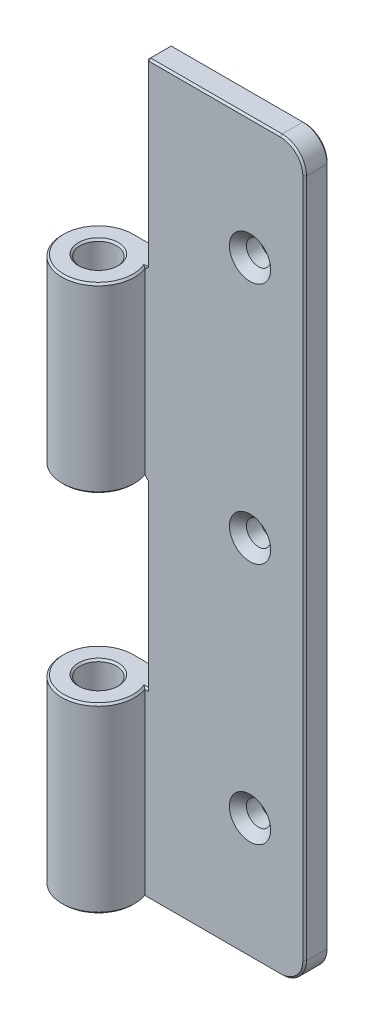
SolidWorks part; units mm, degrees
ref_plane "Спереди" through (0, 0, 0) normal (0, 0, 1) x (1, 0, 0)
ref_plane "Сверху" through (0, 0, 0) normal (0, 1, 0) x (1, 0, 0)
ref_plane "Справа" through (0, 0, 0) normal (1, 0, 0) x (0, 0, -1)
sketch "Эскиз1" plane through (0, 0, 0) normal (0, 1, 0) x (1, 0, 0)
  circle A0 centre (0, 0) radius 1.5
  circle A1 centre (0, 0) radius 3
  dimension "D1" = 6
  dimension "D2" = 3
extrude "Бобышка-Вытянуть1" add sketch "Эскиз1" along normal blind 45
sketch "Эскиз2" plane through (0, 0, 0) normal (0, 0, 1) x (1, 0, 0)
  line L0 (-3, 45) -> (-3, 0) construction
  line L1 (3, 30) -> (-3, 30)
  line L2 (3, 30) -> (3, 15)
  line L3 (3, 15) -> (-3, 15)
  line L4 (-3, 30) -> (-3, 15)
  line L5 (3, 30) -> (-3, 15) construction
  line L6 (3, 15) -> (-3, 30) construction
  point P0 (0, 22.5)
  dimension "D1" = 3
  dimension "D2" = 15
  dimension "D3" = 15
extrude "Вырез-Вытянуть1" cut sketch "Эскиз2" against normal mid plane 10
sketch "Эскиз4" plane through (0, 0, 0) normal (0, 1, 0) x (1, 0, 0)
  line L0 (-3, -3.2543) -> (-3, 3) construction
  line L1 (0, 3) -> (16, 3)
  line L2 (0, 3) -> (0, 1.5)
  line L3 (1.118, 1) -> (16, 1)
  line L4 (16, 3) -> (16, 1)
  circle A0 centre (0, 0) radius 3 construction
  circle A2 centre (0, 0) radius 1.5 construction
  arc A3 (1.118, 1) -> (0, 1.5) centre (0, 0) ccw
  dimension "D1" = 19
  dimension "D2" = 2
extrude "Бобышка-Вытянуть2" add sketch "Эскиз4" along normal blind 60
sketch "Эскиз6" plane through (0, 0, 0) normal (0, 0, 1) x (1, 0, 0)
  line L0 (1.118, 60) -> (16, 60) construction
  line L1 (3, 45) -> (-3, 45)
  line L2 (3, 45) -> (3, 60)
  line L3 (3, 60) -> (-3, 60)
  line L4 (-3, 45) -> (-3, 60)
  line L5 (3, 30) -> (-3, 30)
  line L6 (3, 30) -> (3, 15)
  line L7 (3, 15) -> (-3, 15)
  line L8 (-3, 30) -> (-3, 15)
  line L9 (16, 60) -> (16, 0) construction
  circle A0 centre (11.5, 50) radius 1
  circle A1 centre (11.5, 30) radius 1
  circle A2 centre (11.5, 10) radius 1
  dimension "D1" = 2
  dimension "D2" = 20
  dimension "D3" = 20
  dimension "D4" = 10
  dimension "D5" = 4.5
extrude "Вырез-Вытянуть2" cut sketch "Эскиз6" against normal mid plane 10
fillet "Скругление1" radius 2 2 edges at (16, 0, -2) (16, 60, -2)
chamfer "Фаска1" distance 0.7 angle 45 3 edges at (10.5, 10, -1) (10.5, 30, -1) (10.5, 50, -1)
chamfer "Фаска2" distance 0.15 angle 45 34 edges at (0, 30, 1.5) (0, 45, 1.5) (0, 15, -1.5) (0, 0, 1.5) (12.5, 10, -3) (12.5, 30, -3) (12.5, 50, -3) (3, 52.5, -3) (-1.7321, 30, 2.4495) (1.5, 30, -3) (3, 22.5, -3) (1.5, 45, -3) (-1.7321, 45, 2.4495) (8.5, 60, -3) (8.5, 60, -1) (15.4142, 59.4142, -3) (15.4142, 59.4142, -1) (16, 30, -3) (16, 30, -1) (15.4142, 0.5858, -3) (15.4142, 0.5858, -1) (7, 0, -3) (8.4142, 0, -1) (-1.7321, 15, 2.4495) (-1.7321, 0, 2.4495) (1.5, 15, -3) (2.9142, 45, -1) (3, 45, -2) (3, 52.5, -1) (3, 60, -2) (2.9142, 30, -1) (3, 30, -2) (3, 22.5, -1) (2.9142, 15, -1)
